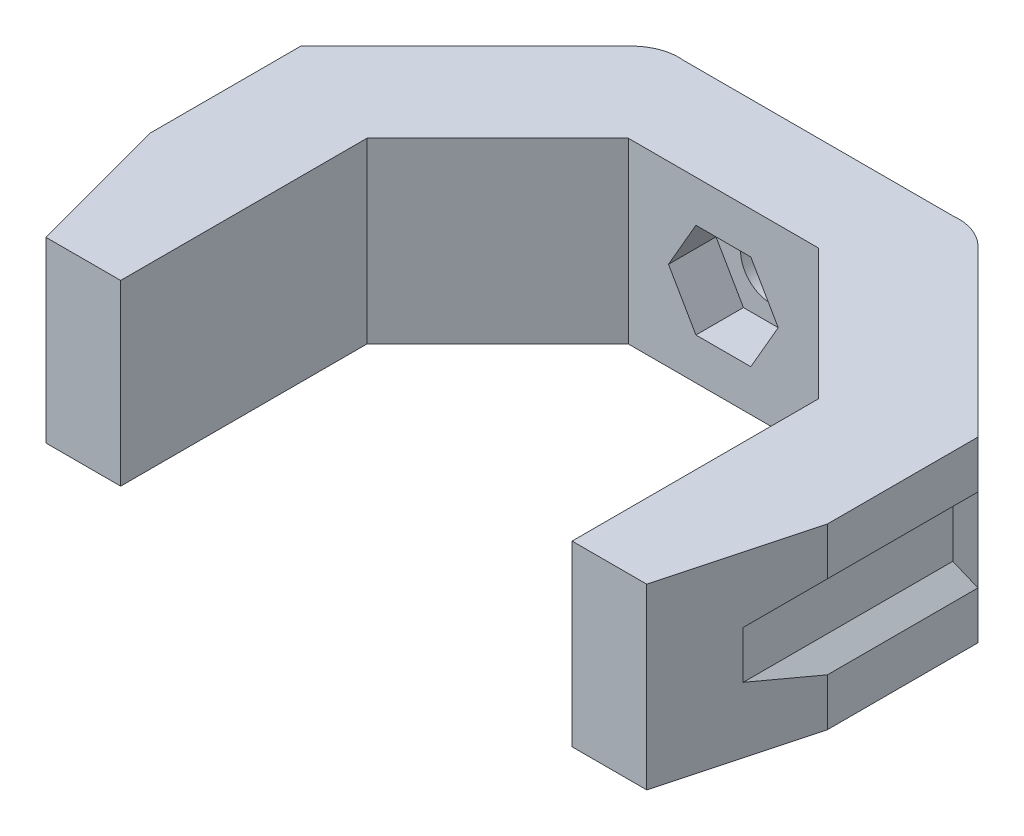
SolidWorks part; units mm, degrees
ref_plane "Front Plane" through (0, 0, 0) normal (0, 0, 1) x (1, 0, 0)
ref_plane "Top Plane" through (0, 0, 0) normal (0, 1, 0) x (1, 0, 0)
ref_plane "Right Plane" through (0, 0, 0) normal (1, 0, 0) x (0, 0, -1)
sketch "MainProfile" plane through (0, 0, 0) normal (0, 1, 0) x (1, 0, 0)
  line L0 (0, 0) -> (0, 20.7345)
  line L1 (0, 20.7345) -> (11, 31.7345)
  line L2 (11, 31.7345) -> (27, 31.7345)
  line L3 (27, 31.7345) -> (38, 20.7345)
  line L4 (38, 20.7345) -> (38, 0)
  line L5 (38, 0) -> (46, 0)
  line L6 (46, 0) -> (46, 24.0482)
  line L7 (46, 24.0482) -> (30.3137, 39.7345)
  line L8 (30.3137, 39.7345) -> (7.6863, 39.7345)
  line L9 (7.6863, 39.7345) -> (-8, 24.0482)
  line L10 (-8, 24.0482) -> (-8, 0)
  line L11 (-8, 0) -> (0, 0)
  point P11 (0, 0)
extrude "MainBody" add sketch "MainProfile" along normal blind 15 contours L9 L10 L11 L0 L1 L2 L3 L4 L5 L6 L7 L8
sketch "Hex" plane through (0, 0, -31.7345) normal (0, 0, 1) x (1, 0, 0)
  line L0 (11, 0) -> (27, 0) construction
  line L1 (21.3094, 3.5) -> (23.6188, 7.5)
  line L2 (23.6188, 7.5) -> (21.3094, 11.5)
  line L3 (21.3094, 11.5) -> (16.6906, 11.5)
  line L4 (16.6906, 11.5) -> (14.3812, 7.5)
  line L5 (14.3812, 7.5) -> (16.6906, 3.5)
  line L6 (16.6906, 3.5) -> (21.3094, 3.5)
  line L7 (11, 15) -> (11, 0) construction
  line L8 (11, 15) -> (27, 15) construction
  circle A0 centre (19, 7.5) radius 4 construction
  point P12 (0, 0)
  point P13 (11, 7.5)
  point P16 (19, 15)
  dimension "D1" = 8
extrude "NutHole" cut sketch "Hex" against normal blind 4 contours L3 L4 L5 L6 L1 L2
sketch "Ridges" plane through (0, 0, 0) normal (0, 0, 1) x (1, 0, 0)
  line L0 (-8, 15) -> (-8, 0) construction
  line L1 (-8, 15) -> (-9.5, 15)
  line L2 (-8, 15) -> (-8, 9.5)
  line L3 (-8, 9.5) -> (-9.5, 11)
  line L4 (-9.5, 15) -> (-9.5, 11)
  line L5 (-8, 0) -> (-9.5, 0)
  line L6 (-8, 0) -> (-8, 5.5)
  line L7 (-8, 5.5) -> (-9.5, 4)
  line L8 (-9.5, 0) -> (-9.5, 4)
  point P10 (0, 0)
  point P11 (0, 0)
  point P12 (-8, 9.8384)
  point P13 (-8, 5.6576)
  point P16 (0, 0)
  point P17 (0, 0)
sketch "SweepPath" plane through (0, 15, 0) normal (0, 1, 0) x (1, 0, 0)
  line L0 (-8, 0) -> (-8, 24.0482)
  line L1 (-8, 24.0482) -> (7.6863, 39.7345)
sweep "SweptRidges" add profiles "Ridges" path "SweepPath"
sketch "5mmHole" plane through (0, 0, -35.7345) normal (0, 0, 1) x (1, 0, 0)
  line L0 (11, 15) -> (27, 15) construction
  line L1 (11, 15) -> (11, 0) construction
  circle A0 centre (19, 7.5) radius 2.55
  point P2 (0, 0)
  point P5 (19, 15)
  point P8 (11, 7.5)
  dimension "D1" = 5.1
extrude "ScrewHole" cut sketch "5mmHole" against normal up to next
ref_plane "CenterPlane" through (19, 0, 0) normal (-1, 0, 0) x (0, 0, 1)
fillet "RidgeFillet" radius 4 2 edges at (6.6256, 13, -40.7952) (6.6256, 2, -40.7952)
mirror "RidgeMirror" about plane through (19, 0, 0) normal (-1, 0, 0) of "RidgeFillet", "SweptRidges"
sketch "Sketch7" plane through (0, 15, 0) normal (0, 1, 0) x (1, 0, 0)
  line L0 (-9.5, 0) -> (-9.5, 12)
  line L1 (-9.5, 0) -> (-9.5, 24.6696) construction
  line L2 (-9.5, 12) -> (-6.2846, 0)
  line L3 (-9.5, 0) -> (0, 0) construction
  line L4 (-6.2846, 0) -> (-9.5, 0)
  dimension "D1" = 15
  dimension "D2" = 12
extrude "BottomChamfer" cut sketch "Sketch7" against normal up to next
mirror "BottomChMirror" about plane through (19, 0, 0) normal (-1, 0, 0) of "BottomChamfer"
equation "\"D5@MainProfile\" = \"D4@MainProfile\""
equation "\"D6@MainProfile\" = \"D4@MainProfile\""
equation "\"D7@MainProfile\" = \"D4@MainProfile\""
equation "\"D8@MainProfile\" = \"D4@MainProfile\""
equation "\"D3@Ridges\" = \"D2@Ridges\""
equation "\"D5@Ridges\"=(15mm-\"D4@Ridges\"-(2*\"D2@Ridges\"))/2"
